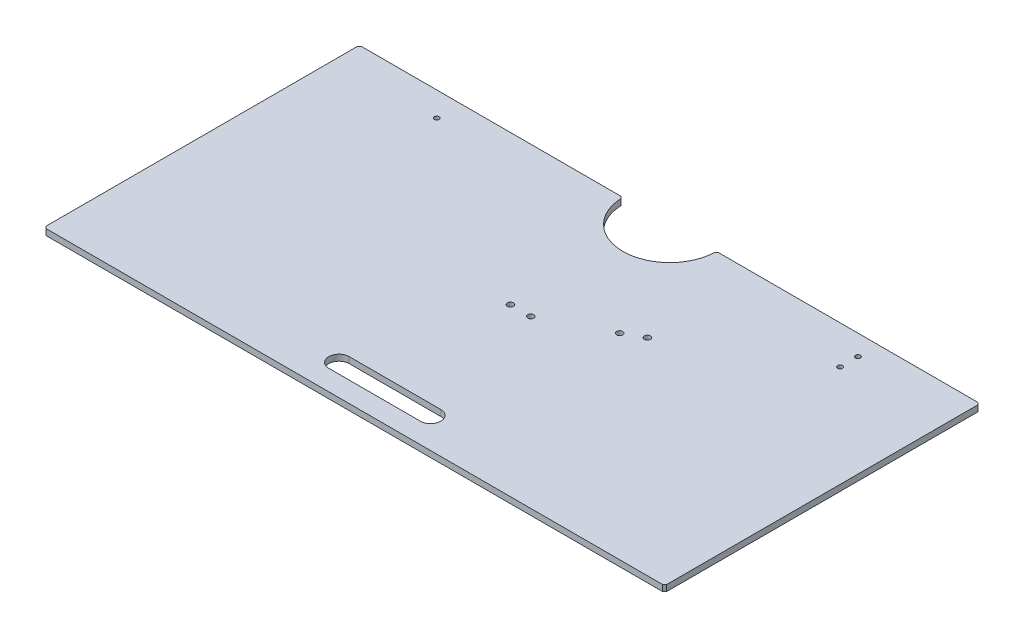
SolidWorks part; units mm, degrees
ref_plane "Plan de face" through (0, 0, 0) normal (0, 0, 1) x (1, 0, 0)
ref_plane "Plan de dessus" through (0, 0, 0) normal (0, 1, 0) x (1, 0, 0)
ref_plane "Plan de droite" through (0, 0, 0) normal (1, 0, 0) x (0, 0, -1)
sketch "Esquisse1" plane through (0, 0, 0) normal (0, 1, 0) x (1, 0, 0)
  line L0 (351, 310) -> (610, 310)
  line L1 (0, 0) -> (610, 0)
  line L2 (0, 0) -> (0, 310)
  line L3 (0, 310) -> (259, 310)
  line L4 (610, 0) -> (610, 310)
  line L5 (259, 310) -> (351, 310) construction
  line L6 (260, 30) -> (350, 30) construction
  line L7 (260, 40) -> (350, 40)
  line L8 (260, 20) -> (350, 20)
  circle A0 centre (100, 286) radius 2.4
  arc A1 (259, 310) -> (351, 310) centre (305, 310) ccw
  circle A2 centre (510, 290) radius 2.4
  circle A3 centre (510, 272.5) radius 2.4
  arc A4 (260, 40) -> (260, 20) centre (260, 30) ccw
  arc A5 (350, 20) -> (350, 40) centre (350, 30) ccw
  point P16 (305, 30)
  dimension "D5" = 4.8
  dimension "D6" = 92
  dimension "D9" = 20
  dimension "D10" = 17.5
  dimension "D11" = 4.8
  dimension "D16" = 30
  dimension "D1" = 310
  dimension "D2" = 610
  dimension "D3" = 100
  dimension "D4" = 24
  dimension "D7" = 305
  dimension "D8" = 510
  dimension "D12" = 259
  dimension "D13" = 260
  dimension "D14" = 90
  dimension "D15" = 20
extrude "Boss.-Extru.1" add sketch "Esquisse1" along normal blind 6
chamfer "Chanfrein1" distance 2 angle 45 6 edges at (610, 3, 0) (0, 3, 0) (0, 3, -310) (610, 3, -310) (351, 3, -310) (259, 3, -310)
sketch "Esquisse3" plane through (0, 6, 0) normal (0, 1, 0) x (-1, 0, 0)
  line L0 (-305, -310) -> (-305, 0) construction
  line L2 (-319.1401, -163.5) -> (-244.3068, -163.5) construction
  line L5 (-2, 0) -> (-608, 0) construction
  line L6 (-608, -310) -> (-353, -310) construction
  line L11 (-360.179, -164.7944) -> (-407.0587, -185.2543) construction
  circle A0 centre (-295, -163.5) radius 3
  circle A1 centre (-315, -163.5) radius 3
  circle A4 centre (-390.4184, -202.67) radius 3
  circle A5 centre (-373.0065, -192.83) radius 3
  dimension "D1" = 6
  dimension "D9" = 6
  dimension "D4" = 146.5
  dimension "D5" = 20
  dimension "D8" = 117.17
  dimension "D6" = 107.33
  dimension "D7" = 65
  dimension "D2" = 20
  dimension "D3" = 10
extrude "Enlèv. mat.-Extru.2" cut sketch "Esquisse3" against normal through all
